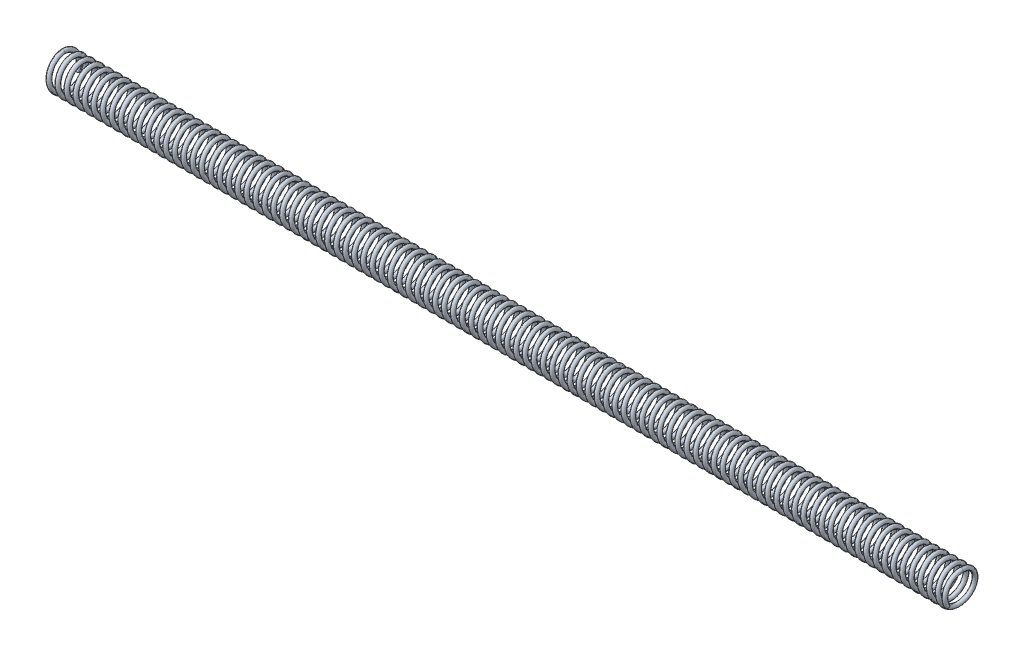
SolidWorks part; units mm, degrees
ref_plane "Спереди" through (0, 0, 0) normal (0, 0, 1) x (1, 0, 0)
ref_plane "Сверху" through (0, 0, 0) normal (0, 1, 0) x (1, 0, 0)
ref_plane "Справа" through (0, 0, 0) normal (1, 0, 0) x (0, 0, -1)
sketch "Эскиз1" plane through (0, 0, 0) normal (0, 0, 1) x (1, 0, 0)
  line L0 (23.7185, -5.0546) -> (23.7185, 5.0546) construction
  circle A0 centre (24.29, 4.445) radius 0.5715
  dimension "D1" = 1.143
  dimension "D2" = 4.445
sketch "Эскиз3" plane through (0, 0, 0) normal (0, 0, 1) x (1, 0, 0)
  line L0 (24.29, 0) -> (271.2542, 0)
  line L1 (271.8257, 5.1855) -> (271.8257, -5.1777) construction
  point P3 (0, 0)
  dimension "D1" = 0.5715
sweep "По траектории1" add profiles "Эскиз1" path "Эскиз3" parameters "D1"=36000
sketch "Эскиз4" plane through (0, 0, 0) normal (0, 0, -1) x (-1, 0, 0)
  line L0 (0, 0) -> (-38.7858, 0) construction
  circle A0 centre (-24.29, 4.445) radius 0.5715 construction
  circle A1 centre (-24.29, 4.445) radius 0.5715
revolve "Повернуть1" add sketch "Эскиз4" angle 120 about L0
sketch "Эскиз5" plane through (0, 0, 0) normal (0, 0, 1) x (1, 0, 0)
  line L0 (266.8671, 0) -> (273.7967, 0) construction
  circle A0 centre (271.2542, 4.445) radius 0.5715 construction
  circle A1 centre (271.2542, 4.445) radius 0.5715
revolve "Повернуть2" add sketch "Эскиз5" angle 120 about L0
